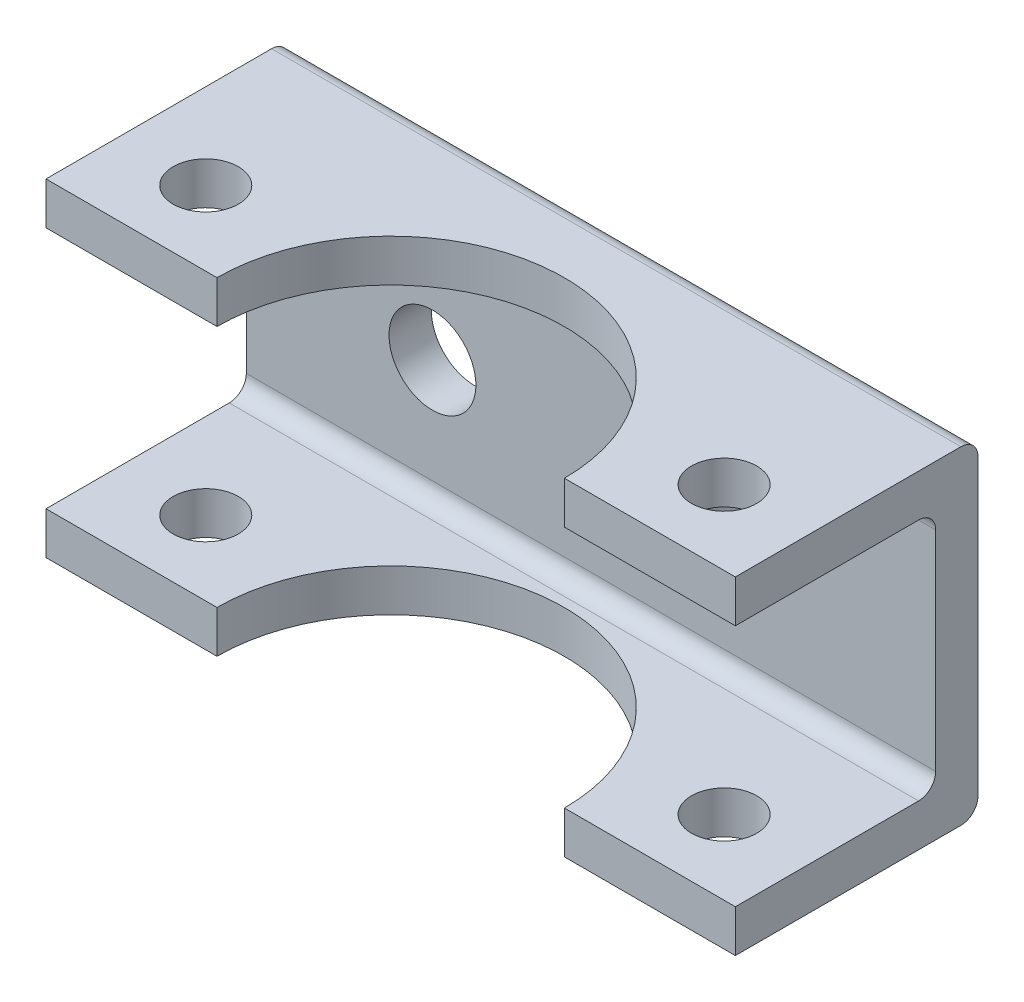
SolidWorks part; units mm, degrees
ref_plane "Front Plane" through (0, 0, 0) normal (0, 0, 1) x (1, 0, 0)
ref_plane "Top Plane" through (0, 0, 0) normal (0, 1, 0) x (1, 0, 0)
ref_plane "Right Plane" through (0, 0, 0) normal (1, 0, 0) x (0, 0, -1)
sketch "Sketch2" plane through (0, 0, 0) normal (0, 0, 1) x (1, 0, 0)
  line L1 (0, 0) -> (63.5, 0)
  line L2 (0, 0) -> (0, 26.31)
  line L3 (0, 26.31) -> (63.5, 26.31)
  line L4 (63.5, 0) -> (63.5, 26.31)
  dimension "D1" = 63.5
  dimension "D2" = 26.31
extrude "Boss-Extrude1" add sketch "Sketch2" along normal blind 3.9 contours L1 L4 L3 L2
sketch "Sketch3" plane through (0, 0, 0) normal (0, 1, 0) x (1, 0, 0)
  line L1 (0, 0) -> (63.5, 0)
  line L2 (0, 0) -> (0, -22.352)
  line L3 (0, -22.352) -> (63.5, -22.352)
  line L4 (63.5, 0) -> (63.5, -22.352)
  dimension "D1" = 63.5
  dimension "D2" = 22.352
extrude "Boss-Extrude2" add sketch "Sketch3" along normal blind 3.9
fillet "Fillet1" radius 1.5748 1 edges at (31.75, 3.9, 3.9)
sketch "Sketch8" plane through (0, 26.31, 0) normal (0, 1, 0) x (1, 0, 0)
  line L1 (0, 0) -> (63.5, 0)
  line L2 (0, 0) -> (0, -22.352)
  line L3 (0, -22.352) -> (63.5, -22.352)
  line L4 (63.5, 0) -> (63.5, -22.352)
extrude "Boss-Extrude4" add sketch "Sketch8" along normal blind 3.9
fillet "Fillet6" radius 1.5748 1 edges at (31.75, 26.31, 3.9)
sketch "Sketch10" plane through (0, 30.21, 0) normal (0, 1, 0) x (1, 0, 0)
  line L1 (0, -22.352) -> (63.5, -22.352) construction
  line L2 (15.75, -22.352) -> (47.75, -22.352)
  arc A0 (47.75, -22.352) -> (15.75, -22.352) centre (31.75, -22.352) ccw
  dimension "D1" = 16
extrude "Cut-Extrude4" cut sketch "Sketch10" against normal through all
sketch "Sketch11" plane through (0, 0, 0) normal (0, 0, -1) x (-1, 0, 0)
  line L0 (-63.5, 15.105) -> (0, 15.105) construction
  line L1 (-63.5, 0) -> (-63.5, 30.21) construction
  line L2 (0, 0) -> (0, 30.21) construction
  circle A0 centre (-46.355, 15.105) radius 4
  circle A1 centre (-17.145, 15.105) radius 4
  point P10 (0, 0)
  point P11 (-45.7485, 13.5614)
  point P12 (0, 0)
  point P13 (-46.6516, 13.5614)
  dimension "D1" = 8
  dimension "D2" = 8
  dimension "D4" = 17.145
  dimension "D3" = 29.21
extrude "Cut-Extrude5" cut sketch "Sketch11" against normal blind 10
sketch "Sketch12" plane through (0, 30.21, 0) normal (0, 1, 0) x (1, 0, 0)
  line L0 (47.75, -22.352) -> (63.5, -22.352) construction
  line L1 (0, -22.352) -> (15.75, -22.352) construction
  circle A0 centre (7.875, -15.512) radius 3
  circle A1 centre (55.625, -15.512) radius 3
  point P6 (0, 0)
  point P7 (55.625, -22.352)
  point P10 (7.875, -22.352)
  point P11 (0, 0)
  dimension "D1" = 6
  dimension "D2" = 6
  dimension "D3" = 6.84
extrude "Cut-Extrude6" cut sketch "Sketch12" against normal through all
fillet "Fillet7" radius 1.5748 2 edges at (31.75, 30.21, 0) (31.75, 0, 0)
